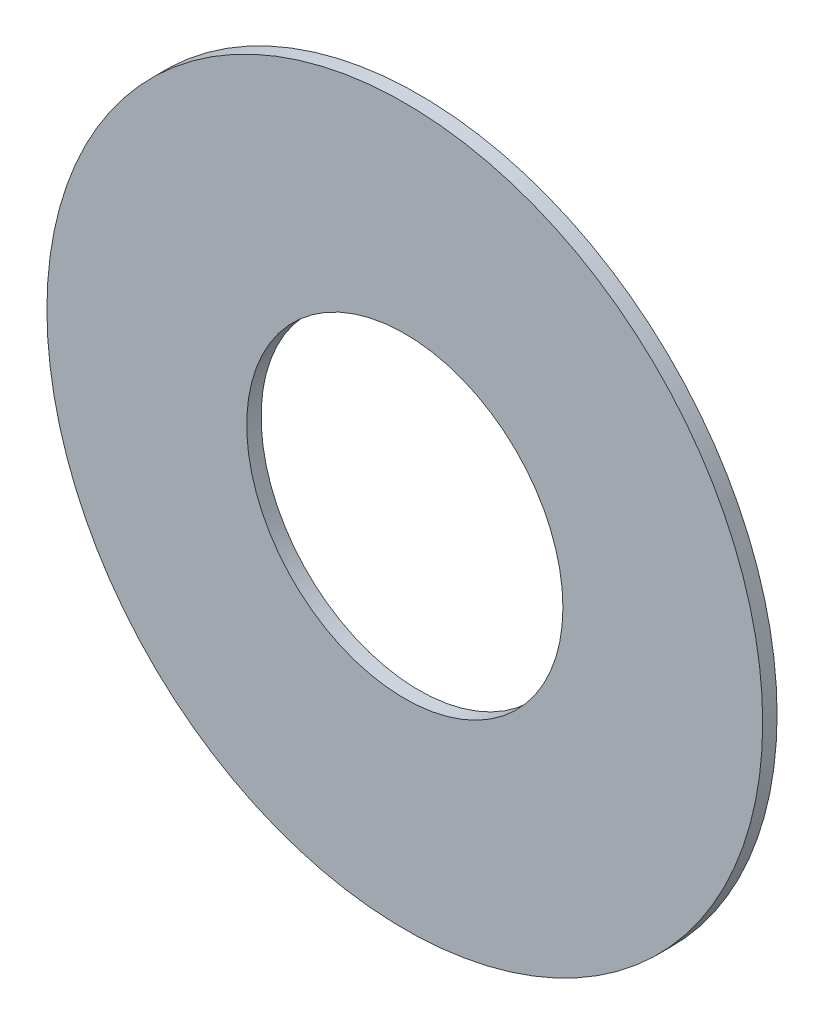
SolidWorks part; units mm, degrees
ref_plane "Plan de face" through (0, 0, 0) normal (0, 0, 1) x (1, 0, 0)
ref_plane "Plan de dessus" through (0, 0, 0) normal (0, 1, 0) x (1, 0, 0)
ref_plane "Plan de droite" through (0, 0, 0) normal (1, 0, 0) x (0, 0, -1)
sketch "Esquisse1" plane through (0, 0, 0) normal (0, 0, 1) x (1, 0, 0)
  circle A0 centre (0, 0) radius 12.45
  circle A1 centre (0, 0) radius 5.5
  dimension "D1" = 24.9
  dimension "D2" = 11
extrude "Extrusion1" add sketch "Esquisse1" along normal blind 0.5
